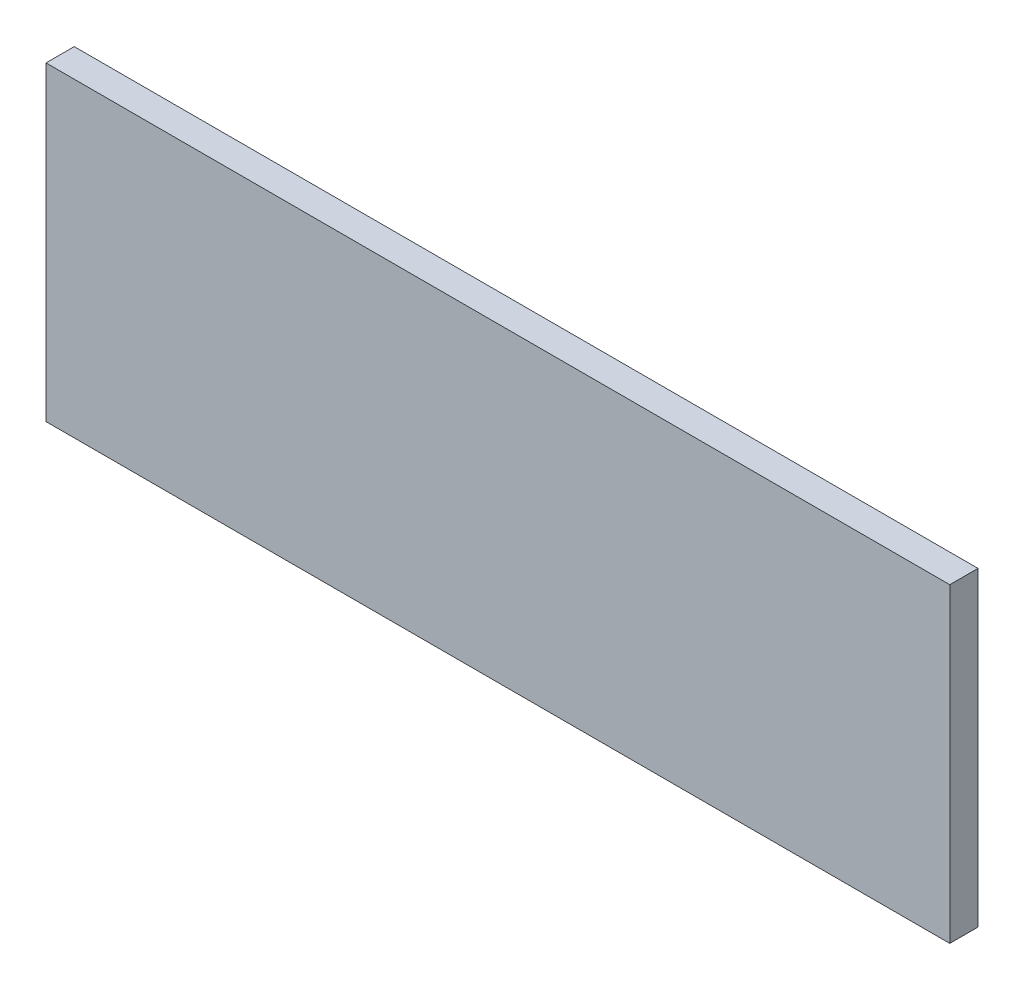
SolidWorks part; units mm, degrees
ref_plane "Front" through (0, 0, 0) normal (0, 0, 1) x (1, 0, 0)
ref_plane "Top" through (0, 0, 0) normal (0, 1, 0) x (1, 0, 0)
ref_plane "Right" through (0, 0, 0) normal (1, 0, 0) x (0, 0, -1)
sketch "Sketch1" plane through (0, 0, 0) normal (0, 0, 1) x (1, 0, 0)
  line L0 (-203.2, 69.85) -> (203.2, -69.85) construction
  line L1 (-203.2, 69.85) -> (203.2, 69.85)
  line L2 (-203.2, 69.85) -> (-203.2, -69.85)
  line L3 (-203.2, -69.85) -> (203.2, -69.85)
  line L4 (203.2, 69.85) -> (203.2, -69.85)
  point P4 (0, 0)
  dimension "D1" = 406.4
  dimension "D3" = 139.7
extrude "Extrude1" add sketch "Sketch1" along normal blind 12.7
